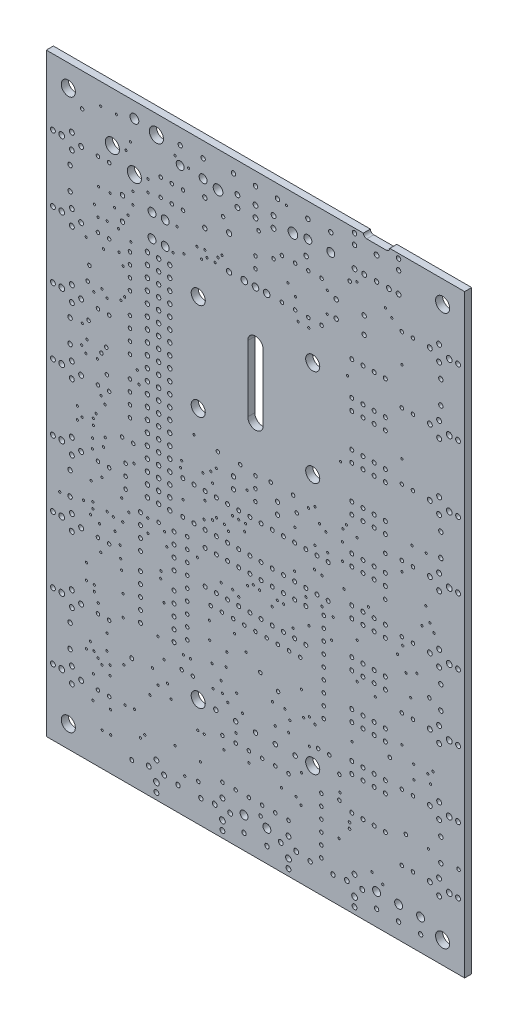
SolidWorks part; units mm, degrees
ref_plane "Plan de face" through (0, 0, 0) normal (0, 0, 1) x (1, 0, 0)
ref_plane "Plan de dessus" through (0, 0, 0) normal (0, 1, 0) x (1, 0, 0)
ref_plane "Plan de droite" through (0, 0, 0) normal (1, 0, 0) x (0, 0, -1)
sketch "Model" plane through (0, 0, 0) normal (0, 0, 1) x (1, 0, 0)
  line L0 (45.75, 100.75) -> (45.75, 85.75)
  line L1 (0, 0) -> (95, 0)
  line L2 (0, 0) -> (0, 135)
  line L3 (0, 135) -> (71.998, 135)
  line L4 (95, 0) -> (95, 135)
  line L5 (49.25, 100.75) -> (49.25, 85.75)
  line L6 (72.748, 134.25) -> (77.248, 134.25)
  line L7 (77.998, 135) -> (95, 135)
  circle A0 centre (35.1, 5.4) radius 0.5
  circle A1 centre (29.9, 5.4) radius 0.5
  circle A2 centre (65.1, 5.4) radius 0.5
  circle A3 centre (59.9, 5.4) radius 0.5
  circle A4 centre (24.999, 1.499) radius 0.55
  circle A5 centre (24.999, 7.899) radius 0.55
  circle A6 centre (26.749, 5.799) radius 0.55
  circle A7 centre (23.249, 5.799) radius 0.55
  circle A8 centre (24.9987, 3.4991) radius 0.65
  circle A9 centre (39.999, 1.499) radius 0.55
  circle A10 centre (39.999, 7.899) radius 0.55
  circle A11 centre (41.749, 5.799) radius 0.55
  circle A12 centre (38.249, 5.799) radius 0.55
  circle A13 centre (39.9987, 3.4991) radius 0.65
  circle A14 centre (54.999, 1.499) radius 0.55
  circle A15 centre (54.999, 7.899) radius 0.55
  circle A16 centre (56.749, 5.799) radius 0.55
  circle A17 centre (53.249, 5.799) radius 0.55
  circle A18 centre (54.9987, 3.4991) radius 0.65
  circle A19 centre (69.999, 1.499) radius 0.55
  circle A20 centre (69.999, 7.899) radius 0.55
  circle A21 centre (71.749, 5.799) radius 0.55
  circle A22 centre (68.249, 5.799) radius 0.55
  circle A23 centre (69.9987, 3.4991) radius 0.65
  circle A24 centre (17.3, 109.9) radius 0.5
  circle A25 centre (17.3, 115.1) radius 0.5
  circle A26 centre (30.4, 131.5) radius 0.5
  circle A27 centre (35.6, 131.5) radius 0.5
  circle A28 centre (59.4, 131.5) radius 0.5
  circle A29 centre (64.6, 131.5) radius 0.5
  circle A30 centre (19.4, 5.09) radius 0.45
  circle A31 centre (19.4, 25.09) radius 0.45
  circle A32 centre (79.998, 3.5999) radius 0.5
  circle A33 centre (84.998, 3.5999) radius 0.5
  circle A34 centre (74.998, 3.5999) radius 0.5
  circle A35 centre (47.5, 132) radius 0.5
  circle A36 centre (42.5, 132) radius 0.5
  circle A37 centre (52.5, 132) radius 0.5
  circle A38 centre (44.9, 3.5) radius 0.5
  circle A39 centre (50.1, 3.5) radius 0.5
  circle A40 centre (89.6, 25.1) radius 0.5
  circle A41 centre (89.6, 19.9) radius 0.5
  circle A42 centre (89.6, 55.1) radius 0.5
  circle A43 centre (89.6, 49.9) radius 0.5
  circle A44 centre (89.6, 85.1) radius 0.5
  circle A45 centre (89.6, 79.9) radius 0.5
  circle A46 centre (89.6, 115.1) radius 0.5
  circle A47 centre (89.6, 109.9) radius 0.5
  circle A48 centre (72.175, 118.905) radius 0.5
  circle A49 centre (72.175, 115.095) radius 0.5
  circle A50 centre (65.825, 115.095) radius 0.5
  circle A51 centre (65.825, 118.905) radius 0.5
  circle A52 centre (5.4, 19.9) radius 0.5
  circle A53 centre (5.4, 25.1) radius 0.5
  circle A54 centre (5.4, 49.9) radius 0.5
  circle A55 centre (5.4, 55.1) radius 0.5
  circle A56 centre (5.4, 79.9) radius 0.5
  circle A57 centre (5.4, 85.1) radius 0.5
  circle A58 centre (5.4, 109.9) radius 0.5
  circle A59 centre (5.4, 115.1) radius 0.5
  circle A60 centre (50.96, 75.5) radius 0.4
  circle A61 centre (56.04, 75.5) radius 0.4
  circle A62 centre (38.96, 75.5) radius 0.4
  circle A63 centre (44.04, 75.5) radius 0.4
  circle A64 centre (66.5641, 20.7526) radius 0.4
  circle A65 centre (66.5641, 25.8326) radius 0.4
  circle A66 centre (52.5, 69.855) radius 0.4825
  circle A67 centre (52.5, 72.395) radius 0.4825
  circle A68 centre (42.5, 69.855) radius 0.4825
  circle A69 centre (42.5, 72.395) radius 0.4825
  circle A70 centre (41.5, 119.76) radius 0.6
  circle A71 centre (41.5, 112.14) radius 0.6
  circle A72 centre (20.001, 120.498) radius 1.6
  circle A73 centre (15, 123.698) radius 1.6
  circle A74 centre (25, 130.798) radius 1.6
  circle A75 centre (20.0008, 131.4983) radius 1
  circle A76 centre (62.46, 12.43) radius 0.4
  circle A77 centre (62.46, 7.35) radius 0.4
  circle A78 centre (62.46, 9.89) radius 0.4
  circle A79 centre (62.46, 20.05) radius 0.4
  circle A80 centre (62.46, 14.97) radius 0.4
  circle A81 centre (62.46, 17.51) radius 0.4
  circle A82 centre (5, 5) radius 1.6
  circle A83 centre (5, 130) radius 1.6
  circle A84 centre (90, 130) radius 1.6
  circle A85 centre (90, 5) radius 1.6
  circle A86 centre (24, 115.1) radius 0.9
  circle A87 centre (27, 115.1) radius 0.9
  circle A88 centre (24, 109.9) radius 0.9
  circle A89 centre (27, 109.9) radius 0.9
  circle A90 centre (44.9, 7) radius 0.9
  circle A91 centre (50.1, 7) radius 0.9
  circle A92 centre (60.5, 24.5) radius 1.6
  circle A93 centre (34.5, 24.5) radius 1.6
  circle A94 centre (75, 7) radius 0.9
  circle A95 centre (80, 7) radius 0.9
  circle A96 centre (85, 7) radius 0.9
  circle A97 centre (59.4, 127.5) radius 0.9
  circle A98 centre (64.6, 127.5) radius 0.9
  circle A99 centre (30.4, 127.5) radius 0.9
  circle A100 centre (35.6, 127.5) radius 0.9
  circle A101 centre (19, 97.19) radius 0.4
  circle A102 centre (19, 99.73) radius 0.4
  circle A103 centre (19, 102.27) radius 0.4
  circle A104 centre (19, 104.81) radius 0.4
  circle A105 centre (19, 84.69) radius 0.4
  circle A106 centre (19, 87.23) radius 0.4
  circle A107 centre (19, 89.77) radius 0.4
  circle A108 centre (19, 92.31) radius 0.4
  circle A109 centre (19, 72.19) radius 0.4
  circle A110 centre (19, 74.73) radius 0.4
  circle A111 centre (19, 77.27) radius 0.4
  circle A112 centre (19, 79.81) radius 0.4
  circle A113 centre (30.99, 58.69) radius 0.45
  circle A114 centre (33.53, 58.69) radius 0.45
  circle A115 centre (36.07, 58.69) radius 0.45
  circle A116 centre (38.61, 58.69) radius 0.45
  circle A117 centre (41.15, 58.69) radius 0.45
  circle A118 centre (43.69, 58.69) radius 0.45
  circle A119 centre (46.23, 58.69) radius 0.45
  circle A120 centre (48.77, 58.69) radius 0.45
  circle A121 centre (51.31, 58.69) radius 0.45
  circle A122 centre (53.85, 58.69) radius 0.45
  circle A123 centre (56.39, 58.69) radius 0.45
  circle A124 centre (58.93, 58.69) radius 0.45
  circle A125 centre (61.47, 58.69) radius 0.45
  circle A126 centre (64.01, 58.69) radius 0.45
  circle A127 centre (64.01, 66.31) radius 0.45
  circle A128 centre (61.47, 66.31) radius 0.45
  circle A129 centre (58.93, 66.31) radius 0.45
  circle A130 centre (56.39, 66.31) radius 0.45
  circle A131 centre (53.85, 66.31) radius 0.45
  circle A132 centre (51.31, 66.31) radius 0.45
  circle A133 centre (48.77, 66.31) radius 0.45
  circle A134 centre (46.23, 66.31) radius 0.45
  circle A135 centre (43.69, 66.31) radius 0.45
  circle A136 centre (41.15, 66.31) radius 0.45
  circle A137 centre (38.61, 66.31) radius 0.45
  circle A138 centre (36.07, 66.31) radius 0.45
  circle A139 centre (33.53, 66.31) radius 0.45
  circle A140 centre (30.99, 66.31) radius 0.45
  circle A141 centre (36.07, 47.5) radius 0.45
  circle A142 centre (38.61, 47.5) radius 0.45
  circle A143 centre (41.1503, 47.5003) radius 0.45
  circle A144 centre (43.6903, 47.5003) radius 0.45
  circle A145 centre (46.2303, 47.5003) radius 0.45
  circle A146 centre (48.7703, 47.5003) radius 0.45
  circle A147 centre (51.3103, 47.5003) radius 0.45
  circle A148 centre (53.8503, 47.5003) radius 0.45
  circle A149 centre (56.39, 47.5) radius 0.45
  circle A150 centre (56.39, 55.12) radius 0.45
  circle A151 centre (53.85, 55.12) radius 0.45
  circle A152 centre (51.31, 55.12) radius 0.45
  circle A153 centre (48.77, 55.12) radius 0.45
  circle A154 centre (46.23, 55.12) radius 0.45
  circle A155 centre (43.69, 55.12) radius 0.45
  circle A156 centre (41.15, 55.12) radius 0.45
  circle A157 centre (38.61, 55.12) radius 0.45
  circle A158 centre (36.07, 55.12) radius 0.45
  circle A159 centre (58.93, 47.5) radius 0.45
  circle A160 centre (58.93, 55.12) radius 0.45
  circle A161 centre (69.3692, 101.2856) radius 0.45
  circle A162 centre (71.9092, 101.2856) radius 0.45
  circle A163 centre (74.4491, 101.2853) radius 0.45
  circle A164 centre (76.9892, 101.2856) radius 0.45
  circle A165 centre (76.9891, 108.9053) radius 0.45
  circle A166 centre (74.4492, 108.9056) radius 0.45
  circle A167 centre (71.9091, 108.9053) radius 0.45
  circle A168 centre (69.3691, 108.9053) radius 0.45
  circle A169 centre (69.3692, 91.0856) radius 0.45
  circle A170 centre (71.9092, 91.0856) radius 0.45
  circle A171 centre (74.4491, 91.0853) radius 0.45
  circle A172 centre (76.9892, 91.0856) radius 0.45
  circle A173 centre (76.9891, 98.7053) radius 0.45
  circle A174 centre (74.4492, 98.7056) radius 0.45
  circle A175 centre (71.9091, 98.7053) radius 0.45
  circle A176 centre (69.3691, 98.7053) radius 0.45
  circle A177 centre (69.3692, 80.8856) radius 0.45
  circle A178 centre (71.9092, 80.8856) radius 0.45
  circle A179 centre (74.4491, 80.8853) radius 0.45
  circle A180 centre (76.9892, 80.8856) radius 0.45
  circle A181 centre (76.9891, 88.5053) radius 0.45
  circle A182 centre (74.4492, 88.5056) radius 0.45
  circle A183 centre (71.9091, 88.5053) radius 0.45
  circle A184 centre (69.3691, 88.5053) radius 0.45
  circle A185 centre (69.3692, 70.6856) radius 0.45
  circle A186 centre (71.9092, 70.6856) radius 0.45
  circle A187 centre (74.4491, 70.6853) radius 0.45
  circle A188 centre (76.9892, 70.6856) radius 0.45
  circle A189 centre (76.9891, 78.3053) radius 0.45
  circle A190 centre (74.4492, 78.3056) radius 0.45
  circle A191 centre (71.9091, 78.3053) radius 0.45
  circle A192 centre (69.3691, 78.3053) radius 0.45
  circle A193 centre (69.3692, 60.4856) radius 0.45
  circle A194 centre (71.9092, 60.4856) radius 0.45
  circle A195 centre (74.4491, 60.4853) radius 0.45
  circle A196 centre (76.9892, 60.4856) radius 0.45
  circle A197 centre (76.9891, 68.1053) radius 0.45
  circle A198 centre (74.4492, 68.1056) radius 0.45
  circle A199 centre (71.9091, 68.1053) radius 0.45
  circle A200 centre (69.3691, 68.1053) radius 0.45
  circle A201 centre (69.3692, 50.2856) radius 0.45
  circle A202 centre (71.9092, 50.2856) radius 0.45
  circle A203 centre (74.4491, 50.2853) radius 0.45
  circle A204 centre (76.9892, 50.2856) radius 0.45
  circle A205 centre (76.9891, 57.9053) radius 0.45
  circle A206 centre (74.4492, 57.9056) radius 0.45
  circle A207 centre (71.9091, 57.9053) radius 0.45
  circle A208 centre (69.3691, 57.9053) radius 0.45
  circle A209 centre (69.3692, 40.0856) radius 0.45
  circle A210 centre (71.9092, 40.0856) radius 0.45
  circle A211 centre (74.4491, 40.0853) radius 0.45
  circle A212 centre (76.9892, 40.0856) radius 0.45
  circle A213 centre (76.9891, 47.7053) radius 0.45
  circle A214 centre (74.4492, 47.7056) radius 0.45
  circle A215 centre (71.9091, 47.7053) radius 0.45
  circle A216 centre (69.3691, 47.7053) radius 0.45
  circle A217 centre (69.3692, 29.8856) radius 0.45
  circle A218 centre (71.9092, 29.8856) radius 0.45
  circle A219 centre (74.4491, 29.8853) radius 0.45
  circle A220 centre (76.9892, 29.8856) radius 0.45
  circle A221 centre (76.9891, 37.5053) radius 0.45
  circle A222 centre (74.4492, 37.5056) radius 0.45
  circle A223 centre (71.9091, 37.5053) radius 0.45
  circle A224 centre (69.3691, 37.5053) radius 0.45
  circle A225 centre (68.859, 16.261) radius 0.3
  circle A226 centre (68.859, 17.531) radius 0.3
  circle A227 centre (69.3736, 19.6861) radius 0.45
  circle A228 centre (71.9138, 19.6857) radius 0.45
  circle A229 centre (74.4536, 19.6854) radius 0.45
  circle A230 centre (76.9938, 19.6857) radius 0.45
  circle A231 centre (76.9936, 27.3054) radius 0.45
  circle A232 centre (74.4538, 27.3057) radius 0.45
  circle A233 centre (71.9136, 27.3054) radius 0.45
  circle A234 centre (69.3736, 27.3054) radius 0.45
  circle A235 centre (1.499, 15.001) radius 0.55
  circle A236 centre (7.899, 15.001) radius 0.55
  circle A237 centre (5.799, 13.251) radius 0.55
  circle A238 centre (5.799, 16.751) radius 0.55
  circle A239 centre (3.4991, 15.0013) radius 0.65
  circle A240 centre (1.499, 30.001) radius 0.55
  circle A241 centre (7.899, 30.001) radius 0.55
  circle A242 centre (5.799, 28.251) radius 0.55
  circle A243 centre (5.799, 31.751) radius 0.55
  circle A244 centre (3.4991, 30.0013) radius 0.65
  circle A245 centre (1.499, 45.001) radius 0.55
  circle A246 centre (7.899, 45.001) radius 0.55
  circle A247 centre (5.799, 43.251) radius 0.55
  circle A248 centre (5.799, 46.751) radius 0.55
  circle A249 centre (3.4991, 45.0013) radius 0.65
  circle A250 centre (1.499, 60.001) radius 0.55
  circle A251 centre (7.899, 60.001) radius 0.55
  circle A252 centre (5.799, 58.251) radius 0.55
  circle A253 centre (5.799, 61.751) radius 0.55
  circle A254 centre (3.4991, 60.0013) radius 0.65
  circle A255 centre (1.499, 75.001) radius 0.55
  circle A256 centre (7.899, 75.001) radius 0.55
  circle A257 centre (5.799, 73.251) radius 0.55
  circle A258 centre (5.799, 76.751) radius 0.55
  circle A259 centre (3.4991, 75.0013) radius 0.65
  circle A260 centre (1.499, 90.001) radius 0.55
  circle A261 centre (7.899, 90.001) radius 0.55
  circle A262 centre (5.799, 88.251) radius 0.55
  circle A263 centre (5.799, 91.751) radius 0.55
  circle A264 centre (3.4991, 90.0013) radius 0.65
  circle A265 centre (1.499, 105.001) radius 0.55
  circle A266 centre (7.899, 105.001) radius 0.55
  circle A267 centre (5.799, 103.251) radius 0.55
  circle A268 centre (5.799, 106.751) radius 0.55
  circle A269 centre (3.4991, 105.0013) radius 0.65
  circle A270 centre (1.499, 120.001) radius 0.55
  circle A271 centre (7.899, 120.001) radius 0.55
  circle A272 centre (5.799, 118.251) radius 0.55
  circle A273 centre (5.799, 121.751) radius 0.55
  circle A274 centre (3.4991, 120.0013) radius 0.65
  circle A275 centre (25.96, 123) radius 0.4
  circle A276 centre (28.5, 123) radius 0.4
  circle A277 centre (31.04, 123) radius 0.4
  circle A278 centre (31.04, 119) radius 0.4
  circle A279 centre (28.5, 119) radius 0.4
  circle A280 centre (25.96, 119) radius 0.4
  circle A281 centre (18, 57.6469) radius 0.4
  circle A282 centre (18, 60.1869) radius 0.4
  circle A283 centre (18, 62.7269) radius 0.4
  circle A284 centre (74.9976, 132.1917) radius 0.55
  circle A285 centre (79.9973, 126.9914) radius 0.55
  circle A286 centre (77.7976, 126.9917) radius 0.55
  circle A287 centre (72.1976, 126.9917) radius 0.55
  circle A288 centre (69.9976, 126.9917) radius 0.55
  circle A289 centre (74.9976, 126.9917) radius 0.5
  circle A290 centre (79.9976, 133.9917) radius 0.5
  circle A291 centre (79.9976, 131.6917) radius 0.5
  circle A292 centre (69.9976, 133.9917) radius 0.5
  circle A293 centre (69.9976, 131.6917) radius 0.5
  arc A295 (77.248, 134.25) -> (77.998, 135) centre (77.248, 135) ccw
  arc A296 (71.998, 135) -> (72.748, 134.25) centre (72.748, 135) ccw
  circle A299 centre (21.38, 49.72) radius 0.45
  circle A300 centre (21.38, 47.18) radius 0.45
  circle A301 centre (29, 47.18) radius 0.45
  circle A302 centre (29, 49.72) radius 0.45
  circle A303 centre (21.38, 54.8) radius 0.45
  circle A304 centre (21.38, 52.26) radius 0.45
  circle A305 centre (29, 52.26) radius 0.45
  circle A306 centre (29, 54.8) radius 0.45
  circle A307 centre (21.38, 38.12) radius 0.45
  circle A308 centre (21.38, 35.58) radius 0.45
  circle A309 centre (29, 35.58) radius 0.45
  circle A310 centre (29, 38.12) radius 0.45
  circle A311 centre (21.38, 43.2) radius 0.45
  circle A312 centre (21.38, 40.66) radius 0.45
  circle A313 centre (29, 40.66) radius 0.45
  circle A314 centre (29, 43.2) radius 0.45
  circle A315 centre (29, 33.04) radius 0.45
  circle A316 centre (21.38, 33.04) radius 0.45
  circle A317 centre (83.27, 15) radius 0.4
  circle A318 centre (80.73, 15) radius 0.4
  circle A319 centre (83.27, 30) radius 0.4
  circle A320 centre (80.73, 30) radius 0.4
  circle A321 centre (83.27, 45) radius 0.4
  circle A322 centre (80.73, 45) radius 0.4
  circle A323 centre (83.27, 60) radius 0.4
  circle A324 centre (80.73, 60) radius 0.4
  circle A325 centre (83.27, 75) radius 0.4
  circle A326 centre (80.73, 75) radius 0.4
  circle A327 centre (83.27, 90) radius 0.4
  circle A328 centre (80.73, 90) radius 0.4
  circle A329 centre (83.27, 105) radius 0.4
  circle A330 centre (80.73, 105) radius 0.4
  circle A331 centre (83.27, 120) radius 0.4
  circle A332 centre (80.73, 120) radius 0.4
  circle A333 centre (47.5027, 115.7273) radius 0.4
  circle A334 centre (47.5027, 118.2673) radius 0.4
  circle A335 centre (33.27, 28.5) radius 0.4
  circle A336 centre (30.73, 28.5) radius 0.4
  circle A337 centre (14.27, 15) radius 0.4
  circle A338 centre (11.73, 15) radius 0.4
  circle A339 centre (14.27, 30) radius 0.4
  circle A340 centre (11.73, 30) radius 0.4
  circle A341 centre (14.27, 45) radius 0.4
  circle A342 centre (11.73, 45) radius 0.4
  circle A343 centre (14.27, 60) radius 0.4
  circle A344 centre (11.73, 60) radius 0.4
  circle A345 centre (14.27, 75) radius 0.4
  circle A346 centre (11.73, 75) radius 0.4
  circle A347 centre (14.27, 90) radius 0.4
  circle A348 centre (11.73, 90) radius 0.4
  circle A349 centre (14.27, 105) radius 0.4
  circle A350 centre (11.73, 105) radius 0.4
  circle A351 centre (14.27, 120) radius 0.4
  circle A352 centre (11.73, 120) radius 0.4
  circle A353 centre (19.7391, 67.5) radius 0.4
  circle A354 centre (17.1991, 67.5) radius 0.4
  circle A355 centre (64.27, 28.5) radius 0.4
  circle A356 centre (61.73, 28.5) radius 0.4
  circle A357 centre (93.501, 14.999) radius 0.55
  circle A358 centre (87.101, 14.999) radius 0.55
  circle A359 centre (89.201, 16.749) radius 0.55
  circle A360 centre (89.201, 13.249) radius 0.55
  circle A361 centre (91.5009, 14.9987) radius 0.65
  circle A362 centre (93.501, 29.999) radius 0.55
  circle A363 centre (87.101, 29.999) radius 0.55
  circle A364 centre (89.201, 31.749) radius 0.55
  circle A365 centre (89.201, 28.249) radius 0.55
  circle A366 centre (91.5009, 29.9987) radius 0.65
  circle A367 centre (93.501, 44.999) radius 0.55
  circle A368 centre (87.101, 44.999) radius 0.55
  circle A369 centre (89.201, 46.749) radius 0.55
  circle A370 centre (89.201, 43.249) radius 0.55
  circle A371 centre (91.5009, 44.9987) radius 0.65
  circle A372 centre (93.501, 59.999) radius 0.55
  circle A373 centre (87.101, 59.999) radius 0.55
  circle A374 centre (89.201, 61.749) radius 0.55
  circle A375 centre (89.201, 58.249) radius 0.55
  circle A376 centre (91.5009, 59.9987) radius 0.65
  circle A377 centre (93.501, 74.999) radius 0.55
  circle A378 centre (87.101, 74.999) radius 0.55
  circle A379 centre (89.201, 76.749) radius 0.55
  circle A380 centre (89.201, 73.249) radius 0.55
  circle A381 centre (91.5009, 74.9987) radius 0.65
  circle A382 centre (93.501, 89.999) radius 0.55
  circle A383 centre (87.101, 89.999) radius 0.55
  circle A384 centre (89.201, 91.749) radius 0.55
  circle A385 centre (89.201, 88.249) radius 0.55
  circle A386 centre (91.5009, 89.9987) radius 0.65
  circle A387 centre (93.501, 104.999) radius 0.55
  circle A388 centre (87.101, 104.999) radius 0.55
  circle A389 centre (89.201, 106.749) radius 0.55
  circle A390 centre (89.201, 103.249) radius 0.55
  circle A391 centre (91.5009, 104.9987) radius 0.65
  circle A392 centre (93.501, 119.999) radius 0.55
  circle A393 centre (87.101, 119.999) radius 0.55
  circle A394 centre (89.201, 121.749) radius 0.55
  circle A395 centre (89.201, 118.249) radius 0.55
  circle A396 centre (91.5009, 119.9987) radius 0.65
  circle A397 centre (47.5, 69.96) radius 0.4
  circle A398 centre (47.5, 72.5) radius 0.4
  circle A399 centre (47.5, 75.04) radius 0.4
  circle A400 centre (53.5, 112.15) radius 0.4
  circle A401 centre (53.5, 121.35) radius 0.4
  circle A402 centre (52, 11) radius 0.4
  circle A403 centre (52, 20.2) radius 0.4
  circle A404 centre (62.5, 112.15) radius 0.4
  circle A405 centre (62.5, 121.35) radius 0.4
  circle A406 centre (59.5, 112.15) radius 0.4
  circle A407 centre (59.5, 121.35) radius 0.4
  circle A408 centre (56.5, 121.35) radius 0.4
  circle A409 centre (56.5, 112.15) radius 0.4
  circle A410 centre (40, 11) radius 0.4
  circle A411 centre (40, 20.2) radius 0.4
  circle A412 centre (43, 11) radius 0.4
  circle A413 centre (43, 20.2) radius 0.4
  circle A414 centre (55, 11) radius 0.4
  circle A415 centre (55, 20.2) radius 0.4
  circle A416 centre (46, 11) radius 0.4
  circle A417 centre (46, 20.2) radius 0.4
  circle A418 centre (49, 11) radius 0.4
  circle A419 centre (49, 20.2) radius 0.4
  circle A420 centre (50.04, 112.15) radius 0.75
  circle A421 centre (47.5, 112.15) radius 0.75
  circle A422 centre (44.96, 112.15) radius 0.75
  circle A423 centre (34.5, 81.75) radius 1.6
  circle A424 centre (60.5, 81.75) radius 1.6
  circle A425 centre (60.5, 103.75) radius 1.6
  circle A426 centre (34.5, 103.75) radius 1.6
  arc A427 (45.75, 85.75) -> (49.25, 85.75) centre (47.5, 85.75) ccw
  arc A437 (49.25, 100.75) -> (45.75, 100.75) centre (47.5, 100.75) ccw
  circle A438 centre (37.34, 44.4) radius 0.4
  circle A439 centre (39.88, 44.4) radius 0.4
  circle A440 centre (42.42, 44.4) radius 0.4
  circle A441 centre (44.96, 44.4) radius 0.4
  circle A442 centre (47.5, 44.4) radius 0.4
  circle A443 centre (50.04, 44.4) radius 0.4
  circle A444 centre (52.58, 44.4) radius 0.4
  circle A445 centre (55.12, 44.4) radius 0.4
  circle A446 centre (57.66, 44.4) radius 0.4
  circle A447 centre (63, 35) radius 0.4
  circle A448 centre (63, 37.54) radius 0.4
  circle A449 centre (63, 40.08) radius 0.4
  circle A450 centre (63, 42.62) radius 0.4
  circle A451 centre (63, 45.16) radius 0.4
  circle A452 centre (63, 47.7) radius 0.4
  circle A453 centre (63, 50.24) radius 0.4
  circle A454 centre (63, 52.78) radius 0.4
  circle A455 centre (63, 55.32) radius 0.4
  circle A456 centre (32, 35) radius 0.4
  circle A457 centre (32, 37.54) radius 0.4
  circle A458 centre (32, 40.08) radius 0.4
  circle A459 centre (32, 42.62) radius 0.4
  circle A460 centre (32, 45.16) radius 0.4
  circle A461 centre (32, 47.7) radius 0.4
  circle A462 centre (32, 50.24) radius 0.4
  circle A463 centre (32, 52.78) radius 0.4
  circle A464 centre (32, 55.32) radius 0.4
  circle A465 centre (47.5, 128.25) radius 0.55
  circle A466 centre (43.4, 128.25) radius 0.55
  circle A467 centre (47.5, 125.75) radius 0.55
  circle A468 centre (43.4, 125.75) radius 0.55
  circle A469 centre (51.6, 128.25) radius 0.55
  circle A470 centre (51.6, 125.75) radius 0.55
  circle A471 centre (56, 127) radius 1.1
  circle A472 centre (39, 127) radius 1.1
  circle A473 centre (36, 118) radius 0.5
  circle A474 centre (36, 124) radius 0.5
  circle A475 centre (59, 124) radius 0.5
  circle A476 centre (47.5, 24.5) radius 0.5
  circle A477 centre (38.5, 24.5) radius 0.5
  circle A478 centre (52, 24.5) radius 0.5
  circle A479 centre (43, 24.5) radius 0.5
  circle A480 centre (56.5, 24.5) radius 0.5
  circle A481 centre (22.96, 63.58) radius 0.5
  circle A482 centre (22.96, 58.5) radius 0.5
  circle A483 centre (22.96, 61.04) radius 0.5
  circle A484 centre (22.96, 66.12) radius 0.5
  circle A485 centre (22.96, 68.66) radius 0.5
  circle A486 centre (22.96, 71.2) radius 0.5
  circle A487 centre (22.96, 73.74) radius 0.5
  circle A488 centre (22.96, 81.36) radius 0.5
  circle A489 centre (22.96, 76.28) radius 0.5
  circle A490 centre (22.96, 78.82) radius 0.5
  circle A491 centre (22.96, 83.9) radius 0.5
  circle A492 centre (22.96, 86.44) radius 0.5
  circle A493 centre (22.96, 94.06) radius 0.5
  circle A494 centre (22.96, 88.98) radius 0.5
  circle A495 centre (22.96, 91.52) radius 0.5
  circle A496 centre (22.96, 96.6) radius 0.5
  circle A497 centre (22.96, 99.14) radius 0.5
  circle A498 centre (22.96, 101.68) radius 0.5
  circle A499 centre (22.96, 104.22) radius 0.5
  circle A500 centre (22.96, 106.76) radius 0.5
  circle A501 centre (25.5, 63.58) radius 0.5
  circle A502 centre (25.5, 58.5) radius 0.5
  circle A503 centre (25.5, 61.04) radius 0.5
  circle A504 centre (25.5, 66.12) radius 0.5
  circle A505 centre (25.5, 68.66) radius 0.5
  circle A506 centre (25.5, 71.2) radius 0.5
  circle A507 centre (25.5, 73.74) radius 0.5
  circle A508 centre (25.5, 81.36) radius 0.5
  circle A509 centre (25.5, 76.28) radius 0.5
  circle A510 centre (25.5, 78.82) radius 0.5
  circle A511 centre (25.5, 83.9) radius 0.5
  circle A512 centre (25.5, 86.44) radius 0.5
  circle A513 centre (25.5, 94.06) radius 0.5
  circle A514 centre (25.5, 88.98) radius 0.5
  circle A515 centre (25.5, 91.52) radius 0.5
  circle A516 centre (25.5, 96.6) radius 0.5
  circle A517 centre (25.5, 99.14) radius 0.5
  circle A518 centre (25.5, 101.68) radius 0.5
  circle A519 centre (25.5, 104.22) radius 0.5
  circle A520 centre (25.5, 106.76) radius 0.5
  circle A521 centre (28.04, 63.58) radius 0.5
  circle A522 centre (28.04, 58.5) radius 0.5
  circle A523 centre (28.04, 61.04) radius 0.5
  circle A524 centre (28.04, 66.12) radius 0.5
  circle A525 centre (28.04, 68.66) radius 0.5
  circle A526 centre (28.04, 71.2) radius 0.5
  circle A527 centre (28.04, 73.74) radius 0.5
  circle A528 centre (28.04, 81.36) radius 0.5
  circle A529 centre (28.04, 76.28) radius 0.5
  circle A530 centre (28.04, 78.82) radius 0.5
  circle A531 centre (28.04, 83.9) radius 0.5
  circle A532 centre (28.04, 86.44) radius 0.5
  circle A533 centre (28.04, 94.06) radius 0.5
  circle A534 centre (28.04, 88.98) radius 0.5
  circle A535 centre (28.04, 91.52) radius 0.5
  circle A536 centre (28.04, 96.6) radius 0.5
  circle A537 centre (28.04, 99.14) radius 0.5
  circle A538 centre (28.04, 101.68) radius 0.5
  circle A539 centre (28.04, 104.22) radius 0.5
  circle A540 centre (28.04, 106.76) radius 0.5
  circle A541 centre (87, 51.1) radius 0.4
  circle A542 centre (40.1358, 122.3224) radius 0.4
  circle A543 centre (8.1356, 127.4956) radius 0.4
  circle A544 centre (48.2087, 123.5709) radius 0.4
  circle A545 centre (68.9, 124) radius 0.4
  circle A546 centre (48.65, 8.7) radius 0.4
  circle A547 centre (12.4451, 73.2436) radius 0.243
  circle A548 centre (10.1962, 55.3858) radius 0.243
  circle A549 centre (10.5583, 51.4526) radius 0.243
  circle A550 centre (14.552, 12.5634) radius 0.243
  circle A551 centre (14.6226, 7.6183) radius 0.243
  circle A552 centre (37.863, 28.3368) radius 0.243
  circle A553 centre (41.2153, 27.2864) radius 0.243
  circle A554 centre (45.3669, 39.2483) radius 0.243
  circle A555 centre (37.0205, 41.3215) radius 0.243
  circle A556 centre (16.92, 94.2451) radius 0.243
  circle A557 centre (16.5138, 103.4938) radius 0.243
  circle A558 centre (35.25, 111.5) radius 0.243
  circle A559 centre (76.4, 9.1) radius 0.243
  circle A560 centre (66.6982, 22.3452) radius 0.243
  circle A561 centre (57.9583, 21.8433) radius 0.243
  circle A562 centre (55.0366, 28.2925) radius 0.243
  circle A563 centre (43.2388, 30.1212) radius 0.243
  circle A564 centre (20.65, 82.4) radius 0.243
  circle A565 centre (11.5919, 80.0297) radius 0.243
  circle A566 centre (10.6695, 67.915) radius 0.243
  circle A567 centre (47, 53.35) radius 0.243
  circle A568 centre (42.3259, 50.0587) radius 0.243
  circle A569 centre (39.7224, 50.1363) radius 0.243
  circle A570 centre (31.25, 110.55) radius 0.243
  circle A571 centre (59.5906, 110.1533) radius 0.243
  circle A572 centre (63.9, 68.1) radius 0.243
  circle A573 centre (67.25, 68.1) radius 0.243
  circle A574 centre (67.6, 62.8) radius 0.243
  circle A575 centre (35.828, 60.5997) radius 0.243
  circle A576 centre (37.35, 70.8) radius 0.243
  circle A577 centre (10.675, 17.6871) radius 0.243
  circle A578 centre (10.5761, 12.376) radius 0.243
  circle A579 centre (12.6974, 7.5787) radius 0.243
  circle A580 centre (28.342, 21.4937) radius 0.243
  circle A581 centre (29.2367, 12.8122) radius 0.243
  circle A582 centre (54.1645, 32.4956) radius 0.243
  circle A583 centre (31.1422, 31.6289) radius 0.243
  circle A584 centre (59.7398, 27.9) radius 0.243
  circle A585 centre (51.9786, 28.0633) radius 0.243
  circle A586 centre (51.3551, 32.5062) radius 0.243
  circle A587 centre (32.722, 31.6614) radius 0.243
  circle A588 centre (35.0054, 12.5279) radius 0.243
  circle A589 centre (27.534, 24.1998) radius 0.243
  circle A590 centre (34.5226, 8.4097) radius 0.4
  circle A591 centre (13.7517, 78.032) radius 0.4
  circle A592 centre (12.5275, 81.6787) radius 0.4
  circle A593 centre (81.6526, 21.5754) radius 0.4
  circle A594 centre (93.6138, 20.6811) radius 0.4
  circle A595 centre (9.8, 97.55) radius 0.4
  circle A596 centre (77, 74.5) radius 0.4
  circle A597 centre (52.6195, 35.1587) radius 0.4
  circle A598 centre (48.6057, 36.8846) radius 0.4
  circle A599 centre (78, 34.9) radius 0.4
  circle A600 centre (51.6, 119.75) radius 0.4
  circle A601 centre (76.95, 65.45) radius 0.4
  circle A602 centre (61, 32.85) radius 0.243
  circle A603 centre (83.4592, 33.2263) radius 0.243
  circle A604 centre (59.75, 33.75) radius 0.243
  circle A605 centre (82.75, 49) radius 0.243
  circle A606 centre (86.1687, 68.7848) radius 0.243
  circle A607 centre (86.6383, 35.9661) radius 0.243
  circle A608 centre (70.6, 46.1) radius 0.243
  circle A609 centre (73.15, 62.05) radius 0.243
  circle A610 centre (88.0346, 64.3629) radius 0.243
  circle A611 centre (86.2696, 79.1939) radius 0.243
  circle A612 centre (83.0622, 79.1) radius 0.243
  circle A613 centre (81.7, 53.35) radius 0.243
  circle A614 centre (84.1497, 54.4593) radius 0.243
  circle A615 centre (25.35, 32.35) radius 0.243
  circle A616 centre (37.6588, 33.1983) radius 0.243
  circle A617 centre (23.0307, 54.4868) radius 0.243
  circle A618 centre (26.8599, 53.7047) radius 0.243
  circle A619 centre (27.3552, 50.9997) radius 0.243
  circle A620 centre (23.1009, 51.4989) radius 0.243
  circle A621 centre (23.5185, 19.9088) radius 0.243
  circle A622 centre (40.3313, 17.5542) radius 0.243
  circle A623 centre (12.65, 20.4) radius 0.243
  circle A624 centre (53.9, 53) radius 0.243
  circle A625 centre (58.95, 56.9) radius 0.243
  circle A626 centre (17.6, 22.9) radius 0.243
  circle A627 centre (25.4039, 22.7748) radius 0.243
  circle A628 centre (44.5497, 26.8404) radius 0.243
  circle A629 centre (31.4439, 7.9391) radius 0.243
  circle A630 centre (48.4108, 53) radius 0.243
  circle A631 centre (43.055, 22.2109) radius 0.243
  circle A632 centre (10.8, 22.2) radius 0.243
  circle A633 centre (10.9, 33.95) radius 0.243
  circle A634 centre (3.0555, 49.6133) radius 0.243
  circle A635 centre (45.7, 52.5) radius 0.243
  circle A636 centre (26.0523, 45.5821) radius 0.243
  circle A637 centre (16.7737, 46.0508) radius 0.243
  circle A638 centre (15.2109, 50.776) radius 0.243
  circle A639 centre (8.1303, 66.8729) radius 0.243
  circle A640 centre (8.9881, 79.8149) radius 0.243
  circle A641 centre (62.6, 56.85) radius 0.243
  circle A642 centre (54.85, 116.65) radius 0.243
  circle A643 centre (18.55, 111.8) radius 0.243
  circle A644 centre (16.4, 108.05) radius 0.243
  circle A645 centre (10.9146, 110.1069) radius 0.243
  circle A646 centre (40.837, 34.0778) radius 0.243
  circle A647 centre (17.4629, 32.1092) radius 0.243
  circle A648 centre (17.4317, 36.7885) radius 0.243
  circle A649 centre (13.3747, 65.5004) radius 0.243
  circle A650 centre (13.3242, 71.9545) radius 0.243
  circle A651 centre (8.1707, 85.3424) radius 0.243
  circle A652 centre (8.0327, 80.996) radius 0.243
  circle A653 centre (42.7406, 41.6029) radius 0.243
  circle A654 centre (64.8, 51.35) radius 0.243
  circle A655 centre (17.0961, 41.2633) radius 0.243
  circle A656 centre (10.4723, 61.8083) radius 0.243
  circle A657 centre (10.5139, 63.9418) radius 0.243
  circle A658 centre (7.05, 65.7806) radius 0.243
  circle A659 centre (7.05, 68.5306) radius 0.243
  circle A660 centre (21.05, 79.75) radius 0.243
  circle A661 centre (9.2413, 82.6962) radius 0.243
  circle A662 centre (9.05, 102.7375) radius 0.243
  circle A663 centre (10.7829, 92.8323) radius 0.243
  circle A664 centre (57.85, 15.4) radius 0.243
  circle A665 centre (57.9329, 38.217) radius 0.243
  circle A666 centre (20.0288, 15.3741) radius 0.243
  circle A667 centre (17.1227, 55.4664) radius 0.243
  circle A668 centre (19.9061, 63.64) radius 0.243
  circle A669 centre (14.5, 21.3) radius 0.243
  circle A670 centre (12.3554, 42.3884) radius 0.243
  circle A671 centre (16.8975, 43.4014) radius 0.243
  circle A672 centre (17.3602, 50.8594) radius 0.243
  circle A673 centre (83.4417, 36.2667) radius 0.243
  circle A674 centre (80.95, 58.35) radius 0.243
  circle A675 centre (24.1057, 25.5187) radius 0.243
  circle A676 centre (40.0182, 28.4931) radius 0.243
  circle A677 centre (15.5, 111.75) radius 0.243
  circle A678 centre (12.3565, 130.1443) radius 0.243
  circle A679 centre (15.9024, 130.2951) radius 0.243
  circle A680 centre (18.1, 124.35) radius 0.243
  circle A681 centre (23.1, 121.2) radius 0.243
  circle A682 centre (77, 122.8) radius 0.243
  circle A683 centre (19.65, 114.35) radius 0.243
  circle A684 centre (19.65, 117.05) radius 0.243
  circle A685 centre (10.7191, 66.5469) radius 0.243
  circle A686 centre (12.6353, 57.2778) radius 0.243
  circle A687 centre (12.9916, 63.4303) radius 0.243
  circle A688 centre (8.4696, 50.6753) radius 0.243
  circle A689 centre (9.1, 38.75) radius 0.243
  circle A690 centre (12.096, 47.8701) radius 0.243
  circle A691 centre (13.8237, 51.1578) radius 0.243
  circle A692 centre (25.9801, 44.0428) radius 0.243
  circle A693 centre (34.3857, 18.4004) radius 0.243
  circle A694 centre (14.45, 19.2) radius 0.243
  circle A695 centre (85.3, 64.45) radius 0.243
  circle A696 centre (12.65, 94.35) radius 0.243
  circle A697 centre (19.0941, 126.5145) radius 0.243
  circle A698 centre (29.2337, 128.8704) radius 0.243
  circle A699 centre (56.4467, 69.3735) radius 0.243
  circle A700 centre (45.0384, 62.8252) radius 0.243
  circle A701 centre (60.8978, 63.2801) radius 0.243
  circle A702 centre (65.15, 56.05) radius 0.243
  circle A703 centre (79.7738, 56.0519) radius 0.243
  circle A704 centre (39.9, 114.6) radius 0.243
  circle A705 centre (34.2, 113.45) radius 0.243
  circle A706 centre (13.8289, 108.2939) radius 0.243
  circle A707 centre (12.991, 102.3652) radius 0.243
  circle A708 centre (13.7749, 93.0966) radius 0.243
  circle A709 centre (80.75, 38.75) radius 0.243
  circle A710 centre (87.82, 37.0283) radius 0.243
  circle A711 centre (70.6, 54.25) radius 0.243
  circle A712 centre (70.5786, 74.3924) radius 0.243
  circle A713 centre (67.3464, 74.5213) radius 0.243
  circle A714 centre (70.55, 124.7) radius 0.243
  circle A715 centre (17.45, 101.25) radius 0.243
  circle A716 centre (17.8, 95.35) radius 0.243
  circle A717 centre (67.25, 71.9) radius 0.243
  circle A718 centre (63.4765, 71.9626) radius 0.243
  circle A719 centre (62.6, 62.95) radius 0.243
  circle A720 centre (43.7, 64.5) radius 0.243
  circle A721 centre (57.1962, 110.205) radius 0.243
  circle A722 centre (61, 68.1) radius 0.243
  circle A723 centre (45.2561, 64.483) radius 0.243
  circle A724 centre (62.0672, 72.8541) radius 0.243
  circle A725 centre (80.75, 72.8) radius 0.243
  circle A726 centre (38.65, 62.35) radius 0.243
  circle A727 centre (30.5, 68.1) radius 0.243
  circle A728 centre (45.5777, 71.2306) radius 0.243
  circle A729 centre (35.55, 69.6) radius 0.243
  circle A730 centre (30.75, 69.6) radius 0.243
  circle A731 centre (19.2, 106.85) radius 0.243
  circle A732 centre (80.75, 95) radius 0.243
  circle A733 centre (61.0282, 75.6878) radius 0.243
  circle A734 centre (40.45, 61.95) radius 0.243
  circle A735 centre (36.0165, 64.4027) radius 0.243
  circle A736 centre (33.55, 76.1) radius 0.243
  circle A737 centre (28.8, 109.55) radius 0.243
  circle A738 centre (80.75, 113.5) radius 0.243
  circle A739 centre (18.7255, 53.4367) radius 0.243
  circle A740 centre (21.3711, 10.4059) radius 0.243
  circle A741 centre (22.3511, 11.4895) radius 0.243
  circle A742 centre (68.4175, 105.1472) radius 0.243
  circle A743 centre (59.5238, 74.6854) radius 0.243
  circle A744 centre (37.75, 61.45) radius 0.243
  circle A745 centre (31.0517, 62.0968) radius 0.243
  circle A746 centre (66.5, 13.2) radius 0.243
  circle A747 centre (86.7635, 21.2696) radius 0.243
  circle A748 centre (87.2584, 34.2735) radius 0.243
  circle A749 centre (69.4476, 33.6785) radius 0.243
  circle A750 centre (68.15, 75.7) radius 0.243
  circle A751 centre (66.8313, 87.4461) radius 0.243
  circle A752 centre (15.5752, 48.1756) radius 0.243
  circle A753 centre (10.0635, 48.677) radius 0.243
  circle A754 centre (10.9, 35.25) radius 0.243
  circle A755 centre (9.1, 35.25) radius 0.243
  circle A756 centre (9.1, 21.8) radius 0.243
  circle A757 centre (46, 17.8) radius 0.243
  circle A758 centre (42.3, 64.55) radius 0.243
  circle A759 centre (37.75, 68.7) radius 0.243
  circle A760 centre (39.7074, 30.8648) radius 0.243
  circle A761 centre (74.7, 45.15) radius 0.243
  circle A762 centre (78.45, 121.55) radius 0.243
  circle A763 centre (63.8, 119.65) radius 0.243
  circle A764 centre (63.8, 114.957) radius 0.243
  circle A765 centre (56.5939, 114.7691) radius 0.243
  circle A766 centre (40.9898, 37.1041) radius 0.243
  circle A767 centre (56.7326, 16.5194) radius 0.243
  circle A768 centre (17.8814, 15.1253) radius 0.243
  circle A769 centre (87.1, 65.9) radius 0.243
  circle A770 centre (56.3948, 60.7151) radius 0.243
  circle A771 centre (9.4, 94.25) radius 0.4
  circle A772 centre (9.5928, 86.6376) radius 0.4
  circle A773 centre (13.6133, 83.3589) radius 0.4
  circle A774 centre (73.955, 10.3105) radius 0.243
  circle A775 centre (36.5, 112.4) radius 0.243
  circle A776 centre (38.35, 112.4) radius 0.243
  circle A777 centre (32.3299, 127.9322) radius 0.243
  circle A778 centre (43.7, 49.3) radius 0.243
  circle A779 centre (58.45, 32.9) radius 0.243
  circle A780 centre (54.5507, 131.733) radius 0.243
  circle A781 centre (11.75, 107.9871) radius 0.243
  circle A782 centre (41.35, 61.05) radius 0.243
  circle A783 centre (38.5902, 72.0323) radius 0.243
  circle A784 centre (39, 113.7) radius 0.243
  circle A785 centre (36, 113.7) radius 0.243
  circle A786 centre (29.7, 115.15) radius 0.243
  circle A787 centre (23.1, 118.55) radius 0.243
  circle A788 centre (14.5033, 114.1358) radius 0.243
  circle A789 centre (11.8656, 114.067) radius 0.243
  circle A790 centre (11.3197, 69.1841) radius 0.243
  circle A791 centre (51.3, 51.2) radius 0.243
  circle A792 centre (59.65, 51.6) radius 0.243
  circle A793 centre (55.2955, 30.8421) radius 0.243
  circle A794 centre (13.8084, 27.2106) radius 0.243
  circle A795 centre (13.75, 23.7) radius 0.243
  circle A796 centre (10, 23.7) radius 0.243
  circle A797 centre (10.5747, 50.059) radius 0.243
  circle A798 centre (11.8, 32.15) radius 0.243
  circle A799 centre (26.75, 28.5) radius 0.243
  circle A800 centre (26.75, 39.65) radius 0.243
  circle A801 centre (52.45, 53) radius 0.243
  circle A802 centre (56.05, 49.3) radius 0.243
  circle A803 centre (37.1, 37.5) radius 0.243
  circle A804 centre (35.8739, 18.3943) radius 0.243
  circle A805 centre (11.75, 21.3) radius 0.243
  circle A806 centre (53.4, 16.6191) radius 0.243
  circle A807 centre (56.8638, 72.395) radius 0.4
  circle A808 centre (25.5, 54.8683) radius 0.4
  circle A809 centre (25.5, 54.8683) radius 0.4
  circle A810 centre (34.3005, 52.3633) radius 0.243
extrude "Boss.-Extru.1" add sketch "Model" along normal blind 1.6
